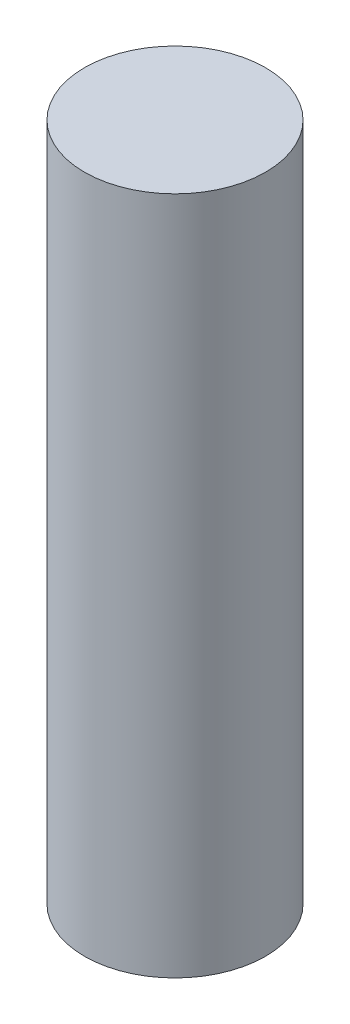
SolidWorks part; units mm, degrees
ref_plane "Front Plane" through (0, 0, 0) normal (0, 0, 1) x (1, 0, 0)
ref_plane "Top Plane" through (0, 0, 0) normal (0, 1, 0) x (1, 0, 0)
ref_plane "Right Plane" through (0, 0, 0) normal (1, 0, 0) x (0, 0, -1)
sketch "Sketch1" plane through (0, 0, 0) normal (0, 1, 0) x (1, 0, 0)
  circle A0 centre (0, 0) radius 2
extrude "Boss-Extrude1" add sketch "Sketch1" along normal blind 15
